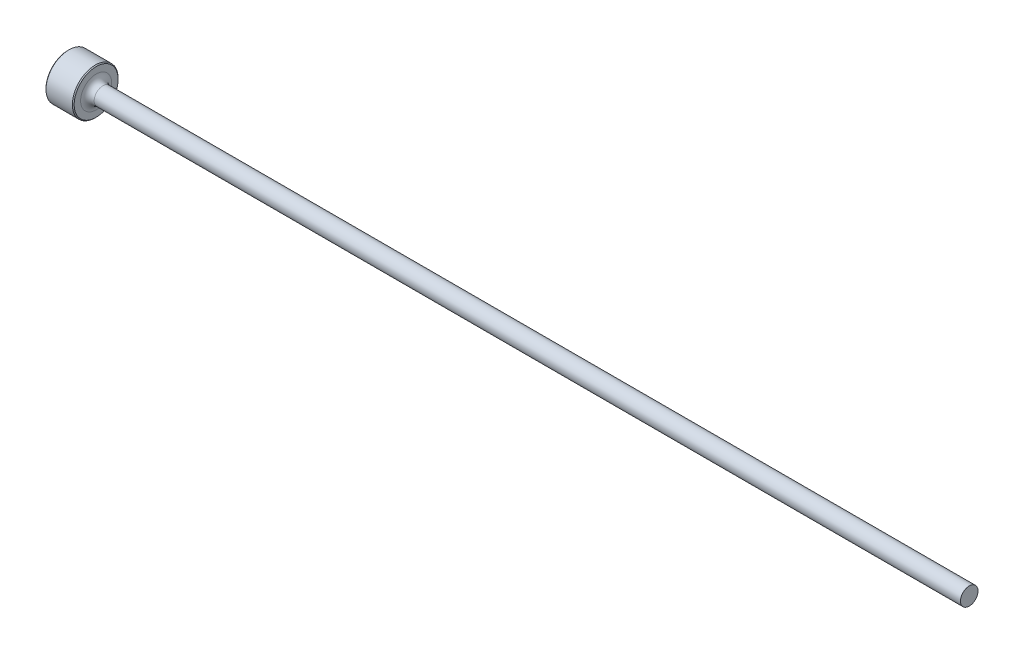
SolidWorks part; units mm, degrees
ref_plane "Front Plane" through (0, 0, 0) normal (0, 0, 1) x (1, 0, 0)
ref_plane "Top Plane" through (0, 0, 0) normal (0, 1, 0) x (1, 0, 0)
ref_plane "Right Plane" through (0, 0, 0) normal (1, 0, 0) x (0, 0, -1)
sketch "Sketch1" plane through (0, 0, 0) normal (0, 0, 1) x (1, 0, 0)
  line L0 (0, 0) -> (0, 2.5797)
  line L1 (0, 2.5797) -> (3.175, 2.5797)
  line L2 (3.175, 2.5797) -> (3.175, 1.7504)
  line L3 (3.937, 0.9884) -> (101.6, 0.9884)
  line L4 (101.6, 0.9884) -> (101.6, 0)
  line L5 (101.6, 0) -> (0, 0)
  line L6 (101.6, 0) -> (101.6, -0.9884) construction
  line L7 (101.6, -0.9884) -> (3.175, -0.9884) construction
  line L8 (0, 0) -> (0, -2.5797) construction
  line L9 (0, -2.5797) -> (3.175, -2.5797) construction
  line L10 (3.175, -2.5797) -> (3.175, -0.9884) construction
  arc A0 (3.175, 1.7504) -> (3.937, 0.9884) centre (3.937, 1.7504) ccw
  dimension "D4" = 0.762
  dimension "L" = 101.6
  dimension "D" = 1.9768
  dimension "H" = 5.1594
  dimension "T" = 3.175
revolve "Revolve1" add sketch "Sketch1" angle 360 about L5
chamfer "Chamfer1" distance 0.1016 angle 45 2 edges at (0, 2.5797, 0) (3.175, 2.5797, 0)
